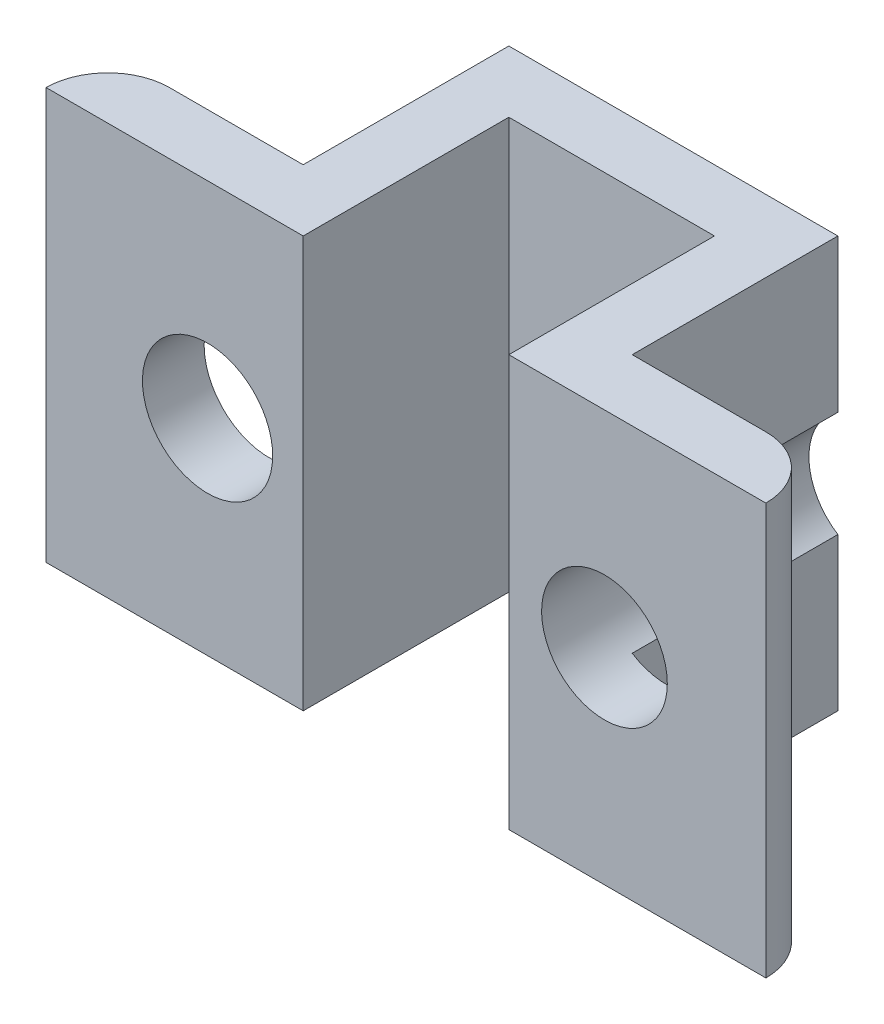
SolidWorks part; units mm, degrees
ref_plane "Alzado" through (0, 0, 0) normal (0, 0, 1) x (1, 0, 0)
ref_plane "Planta" through (0, 0, 0) normal (0, 1, 0) x (1, 0, 0)
ref_plane "Vista lateral" through (0, 0, 0) normal (1, 0, 0) x (0, 0, -1)
sketch "Croquis1" plane through (0, 0, 0) normal (0, 0, 1) x (1, 0, 0)
  line L0 (-17.5, 0) -> (17.5, 0) construction
  line L1 (-17.5, 10) -> (17.5, 10)
  line L2 (-17.5, 10) -> (-17.5, -10)
  line L3 (-17.5, -10) -> (17.5, -10)
  line L4 (17.5, 10) -> (17.5, -10)
  line L5 (-17.5, 10) -> (17.5, -10) construction
  line L6 (-17.5, -10) -> (17.5, 10) construction
  circle A0 centre (-9.65, 0) radius 3.166
  circle A1 centre (9.65, 0) radius 3.0568
  point P0 (0, 0)
  point P12 (-6.484, 0)
  point P13 (6.5932, 0)
  dimension "D1" = 35
  dimension "D2" = 20
  dimension "D3" = 7.85
  dimension "D4" = 7.85
extrude "Saliente-Extruir1" add sketch "Croquis1" along normal blind 20
sketch "Croquis2" plane through (0, 10, 0) normal (0, 1, 0) x (1, 0, 0)
  line L0 (-17.5, -20) -> (17.5, 0) construction
  line L1 (-17.5, 0) -> (17.5, -20) construction
  line L2 (17.5, -20) -> (-17.5, -20) construction
  line L5 (0, -20) -> (5, -20)
  line L7 (-10.3248, 0) -> (10.3248, -20) construction
  line L8 (-10.3248, -20) -> (10.3248, 0) construction
  line L9 (0, 0) -> (0, -20) construction
  line L10 (-5, -10) -> (5, -10)
  line L11 (0, -20) -> (-5, -20)
  line L12 (-5, -20) -> (-5, -10)
  line L13 (5, -20) -> (5, -10)
  point P6 (0, -10)
  dimension "D1" = 5
  dimension "D2" = 5
  dimension "D3" = 10
extrude "Cortar-Extruir4" cut sketch "Croquis2" against normal blind 20
sketch "Croquis4" plane through (0, 10, 0) normal (0, 1, 0) x (1, 0, 0)
  line L0 (-17.5, -20) -> (-17.5, -17.0014)
  line L1 (-17.5, -20) -> (-17.5, 0) construction
  line L2 (-17.5, -17.0014) -> (-8, -17.0014)
  line L3 (-8, -17.0014) -> (-8, -7)
  line L4 (-8, -7) -> (8, -7)
  line L5 (8, -7) -> (8, -17)
  line L6 (8, -17) -> (17.5, -17)
  line L7 (17.5, -20) -> (17.5, 0) construction
  line L8 (17.5, -17) -> (17.5, -20)
  line L9 (17.5, -20) -> (5, -20)
  line L10 (5, -20) -> (5, -10)
  line L11 (5, -10) -> (-5, -10)
  line L12 (-5, -10) -> (-5, -20)
  line L13 (-5, -20) -> (-17.5, -20)
  line L14 (-17.5, -17.0014) -> (-17.5, 0)
  line L15 (-17.5, 0) -> (17.5, 0)
  line L16 (17.5, 0) -> (17.5, -17)
  line L17 (-5, -10) -> (5, -10)
  line L18 (0, 0) -> (0, -20.635) construction
  dimension "D1" = 2.9986
  dimension "D2" = 3
  dimension "D3" = 3
  dimension "D4" = 3
  dimension "D5" = 3
extrude "Cortar-Extruir6" cut sketch "Croquis4" against normal blind 20 contours L18 L15 L2 L3 L4 M18 | L18 L4 L5 L6 M17 M16
fillet "Redondeo3" radius 3 1 edges at (-17.5, 0, 17.0014)
fillet "Redondeo4" radius 3 1 edges at (17.5, 0, 17)
